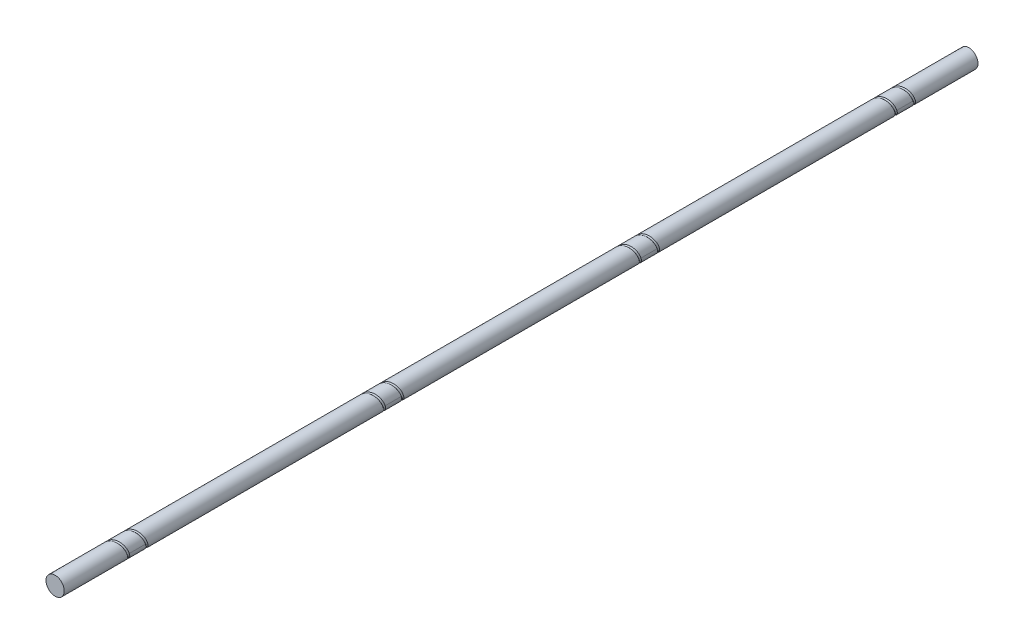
SolidWorks part; units mm, degrees
ref_plane "Front Plane" through (0, 0, 0) normal (0, 0, 1) x (1, 0, 0)
ref_plane "Top Plane" through (0, 0, 0) normal (0, 1, 0) x (1, 0, 0)
ref_plane "Right Plane" through (0, 0, 0) normal (1, 0, 0) x (0, 0, -1)
sketch "Sketch1" plane through (0, 0, 0) normal (0, 0, 1) x (1, 0, 0)
  circle A0 centre (0, 0) radius 25
  dimension "D1" = 50
extrude "Boss-Extrude1" add sketch "Sketch1" along normal blind 2500
ref_plane "Plane1" through (0, 0, 150) normal (0, 0, 1) x (1, 0, 0)
sketch "Sketch2" plane through (0, 0, 150) normal (0, 0, 1) x (1, 0, 0)
  circle A0 centre (0, 0) radius 27.646
  dimension "D1" = 55.292
curve "Helix/Spiral1"
sketch "Sketch3" plane through (0, 0, 0) normal (0, 1, 0) x (1, 0, 0)
  circle A0 centre (-27.646, -150) radius 3.969
  spline S0 degree 3 poles (-27.646, -150) (-27.646, -150.7073) (-26.9833, -152.1286) (-24.0718, -154.2551) (-19.4496, -156.383) (-13.4454, -158.5106) (-6.4857, -160.6383) (0.9349, -162.766) (8.289, -164.8936) (15.0541, -167.0213) (20.7495, -169.1489) (24.9703, -171.2766) (27.4167, -173.4043) (27.9149, -175.5319) (26.4293, -177.6596) (23.0657, -179.7872) (18.063, -181.9149) (11.7766, -184.0426) (4.6535, -186.1702) (-2.8004, -188.2979) (-10.0553, -190.4255) (-16.5956, -192.5532) (-21.9566, -194.6809) (-25.7573, -196.8085) (-27.7277, -198.9362) (-27.7277, -201.0638) (-25.7573, -203.1915) (-21.9566, -205.3191) (-16.5956, -207.4468) (-10.0553, -209.5745) (-2.8004, -211.7021) (4.6535, -213.8298) (11.7766, -215.9574) (18.063, -218.0851) (23.0657, -220.2128) (26.4293, -222.3404) (27.9149, -224.4681) (27.4167, -226.5957) (24.9703, -228.7234) (20.7495, -230.8511) (15.0541, -232.9787) (8.289, -235.1064) (0.9349, -237.234) (-6.4857, -239.3617) (-13.4454, -241.4894) (-19.4496, -243.617) (-24.0718, -245.7449) (-26.9833, -247.8714) (-27.646, -249.2927) (-27.646, -250) knots 0 0 0 0 0.021277 0.042553 0.06383 0.085106 0.106383 0.12766 0.148936 0.170213 0.191489 0.212766 0.234043 0.255319 0.276596 0.297872 0.319149 0.340426 0.361702 0.382979 0.404255 0.425532 0.446809 0.468085 0.489362 0.510638 0.531915 0.553191 0.574468 0.595745 0.617021 0.638298 0.659574 0.680851 0.702128 0.723404 0.744681 0.765957 0.787234 0.808511 0.829787 0.851064 0.87234 0.893617 0.914894 0.93617 0.957447 0.978723 1 1 1 1 construction
  dimension "D1" = 7.938
sweep "Cut-Sweep1" cut profiles "Sketch3" path "Helix/Spiral1"
pattern_linear "LPattern1" count 4 spacing 700 along (0, 0, -1) of "Cut-Sweep1"
